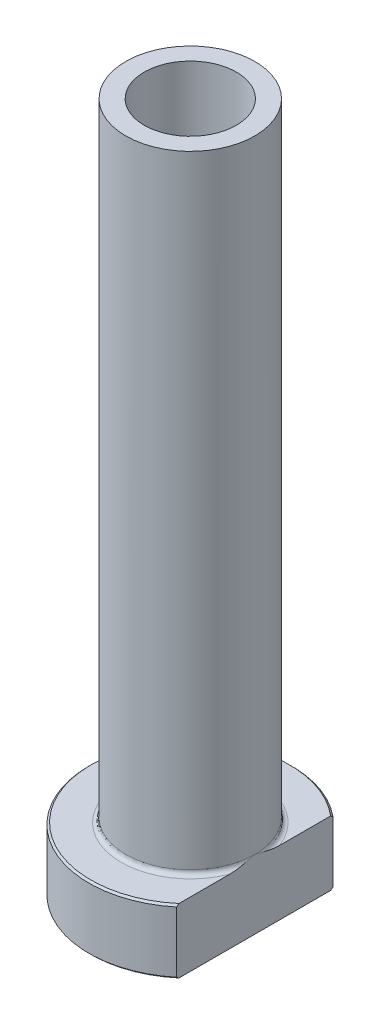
SolidWorks part; units mm, degrees
ref_plane "Front Plane" through (0, 0, 0) normal (0, 0, 1) x (1, 0, 0)
ref_plane "Top Plane" through (0, 0, 0) normal (0, 1, 0) x (1, 0, 0)
ref_plane "Right Plane" through (0, 0, 0) normal (1, 0, 0) x (0, 0, -1)
sketch "Sketch1" plane through (0, 0, 0) normal (0, 0, 1) x (1, 0, 0)
  line L0 (-5, 75) -> (-7, 75)
  line L1 (-7, 75) -> (-7, 7)
  line L2 (-7, 7) -> (-11, 7)
  line L3 (-11, 7) -> (-11, 0)
  line L4 (9.9, 0) -> (-9.9, 0) construction
  line L5 (-11, 0) -> (-5.25, 0)
  line L6 (-5, 30) -> (-5, 75)
  line L7 (0, 92.1877) -> (0, -15.5353) construction
  line L8 (0, -12.1) -> (0, 12.1) construction
  line L9 (-5, 30) -> (-5.25, 18)
  line L10 (-5.25, 18) -> (-5.25, 0)
  dimension "D1" = 0.25
  dimension "ID" = 10
  dimension "OD" = 14
  dimension "L" = 75
  dimension "H" = 22
  dimension "T" = 7
  dimension "N" = 45
  dimension "D2" = 12
  dimension "L-N" = 30
revolve "Revolve1" add sketch "Sketch1" angle 360 about L7
fillet "Fillet1" radius 0.5 1 edges at (0, 7, 7)
chamfer "Chamfer1" distance 0.2 angle 45 2 edges at (0, 7, 11) (0, 0, 11)
sketch "Sketch2" plane through (0, 0, 0) normal (0, -1, 0) x (1, 0, 0)
  line L0 (7, 8.4853) -> (7, -8.4853)
  circle A0 centre (0, 0) radius 11 construction
  arc A1 (7, 8.4853) -> (7, -8.4853) centre (0, 0) cw
  circle A2 centre (0, 0) radius 7 construction
extrude "Cut-Extrude1" cut sketch "Sketch2" against normal through all
chamfer "Chamfer2" distance 0.5 angle 45 1 edges at (0, 0, 5.25)
